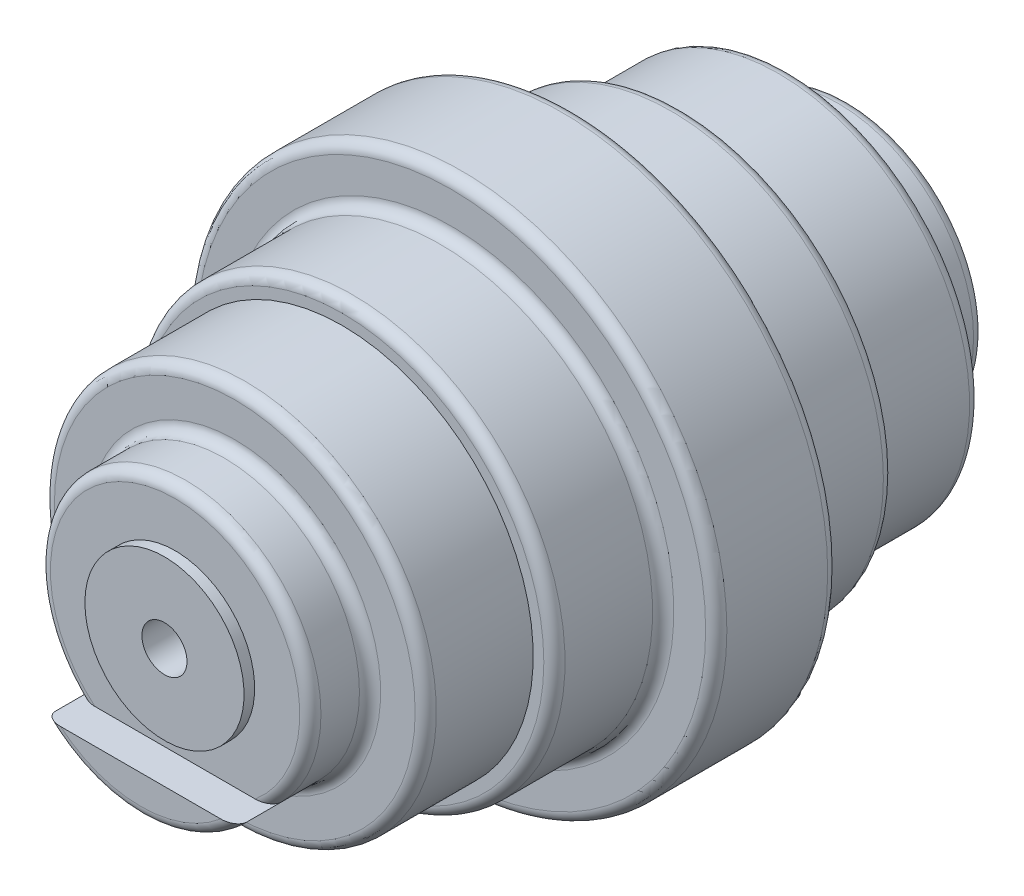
SolidWorks part; units mm, degrees
ref_plane "Face" through (0, 0, 0) normal (0, 0, 1) x (1, 0, 0)
ref_plane "Dessus" through (0, 0, 0) normal (0, 1, 0) x (1, 0, 0)
ref_plane "Droite" through (0, 0, 0) normal (1, 0, 0) x (0, 0, -1)
sketch "Esquisse1" plane through (0, 0, 0) normal (1, 0, 0) x (0, 0, -1)
  line L0 (-34.7499, 0) -> (36.7693, 0) construction
  line L1 (-32, 0) -> (-32, 40)
  line L2 (-32, 40) -> (-11.5, 40)
  line L3 (-11.5, 40) -> (-11.5, 50)
  line L4 (-11.5, 50) -> (11.5, 50)
  line L5 (11.5, 50) -> (11.5, 40)
  line L6 (11.5, 40) -> (32, 40)
  line L7 (32, 40) -> (32, 0)
  line L8 (0, 0) -> (0, 50.1365) construction
  line L9 (-32, 0) -> (32, 0)
  dimension "D1" = 23
  dimension "D2" = 64
  dimension "D3" = 80
  dimension "D4" = 100
revolve "Révolution1" add sketch "Esquisse1" angle 360 about L0
fillet "Congé1" radius 2 6 edges at (50, 0, 11.5) (40, 0, -32) (40, 0, -11.5) (40, 0, 11.5) (40, 0, 32) (50, 0, -11.5)
sketch "Esquisse3" plane through (0, 0, 0) normal (1, 0, 0) x (0, 0, -1)
  line L0 (0, 0) -> (64, 0) construction
  line L1 (32, -36) -> (52.25, -36)
  line L2 (32, -38) -> (32, 38) construction
  line L3 (52.25, -25.5) -> (70, -25.5)
  line L4 (70, -25.5) -> (70, 0)
  line L5 (32, -36) -> (32, 0)
  line L6 (32, 0) -> (70, 0)
  line L7 (52.25, -36) -> (52.25, -25.5)
  line L8 (0, 0) -> (0, 63.6346) construction
  dimension "D1" = 140
  dimension "D2" = 104.5
  dimension "D3" = 72
  dimension "D4" = 51
revolve "Révolution2" add sketch "Esquisse3" angle 360 about L0
fillet "Congé2" radius 2 3 edges at (0, -25.5, -52.25) (0, -36, -52.25) (0, -25.5, -70)
sketch "Esquisse4" plane through (0, 0, -70) normal (0, 0, -1) x (-1, 0, 0)
  line L1 (50, -18) -> (-50, -18)
  line L2 (50, -18) -> (50, 50)
  line L3 (50, 50) -> (-50, 50)
  line L4 (-50, -18) -> (-50, 50)
  circle A1 centre (0, 0) radius 50 construction
  dimension "D1" = 18
extrude "Enlèv. mat.-Extru.1" cut sketch "Esquisse4" against normal blind 4.5
hole_wizard "Trou taraudé M102" positions "Esquisse9" profile "Esquisse8" tap size "M10" standard "ISO"
sketch "Esquisse9" plane through (0, 0, -65.5) normal (0, 0, -1) x (-1, 0, 0)
  point P0 (0, 0)
sketch "Esquisse8" plane through (0, 0, -65.5) normal (1, 0, 0) x (0, 1, 0)
  line L0 (0, 0) -> (0, 26.9537)
  line L1 (0, 26.9537) -> (4.25, 24.5)
  line L2 (4.25, 24.5) -> (4.25, 0)
  line L5 (4.25, 0) -> (0, 0)
  line L10 (0, 26.9537) -> (-4.25, 24.5) construction
  line L11 (0, -6.35) -> (0, 107.95) construction
  dimension "Diamètre du trou pour taraudage" = 8.5
  dimension "Profondeur du trou pour taraudage" = 24.5
  dimension "Angle de pointe" = 120
sketch "Esquisse10" plane through (0, 0, -65.5) normal (0, 0, -1) x (-1, 0, 0)
  line L0 (-18.0624, -18) -> (18.0624, -18) construction
  line L1 (-18.0624, -18) -> (18.0624, -18)
  circle A0 centre (0, 0) radius 15
  circle A1 centre (0, 0) radius 25.5 construction
  arc A2 (18.0624, -18) -> (-18.0624, -18) centre (0, 0) ccw
  dimension "D1" = 30
extrude "Enlèv. mat.-Extru.2" cut sketch "Esquisse10" against normal blind 2
fillet "Congé3" radius 2 1 edges at (0, 25.5, -63.5)
mirror "Symétrie1" about plane through (0, 0, 0) normal (0, 0, 1)
